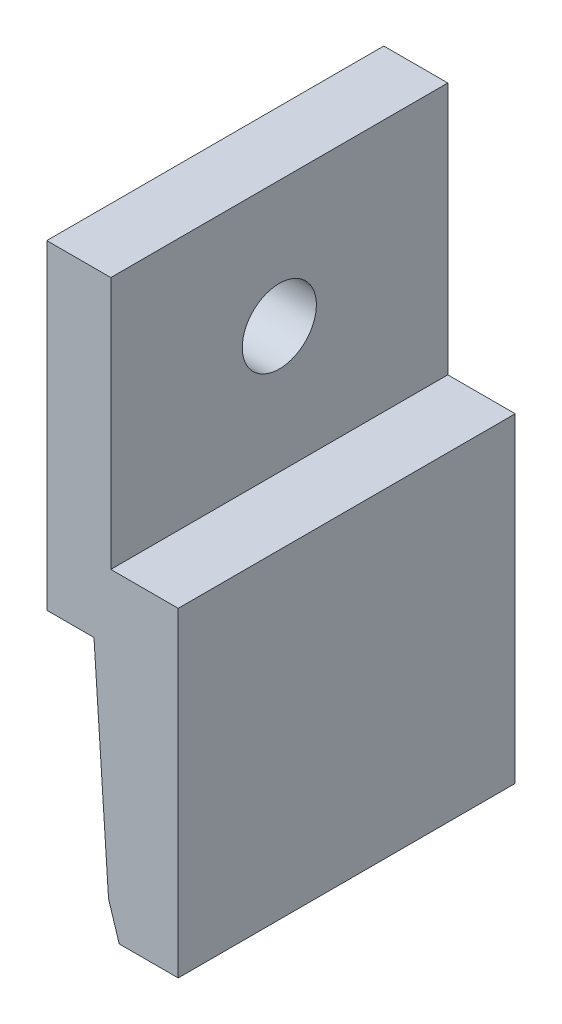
SolidWorks part; units mm, degrees
ref_plane "Спереди" through (0, 0, 0) normal (0, 0, 1) x (1, 0, 0)
ref_plane "Сверху" through (0, 0, 0) normal (0, 1, 0) x (1, 0, 0)
ref_plane "Справа" through (0, 0, 0) normal (1, 0, 0) x (0, 0, -1)
sketch "Эскиз1" plane through (0, 0, 0) normal (0, 0, 1) x (1, 0, 0)
  line L0 (0, 29.4375) -> (0, -32.8125) construction
  line L1 (0, -32.8125) -> (0, 0) construction
  line L2 (0, 0) -> (34.125, 0) construction
  line L3 (34.125, 0) -> (-36, 0) construction
  line L4 (-2, 15) -> (2, 15)
  line L5 (2, 15) -> (2, 0)
  line L6 (2, 0) -> (6, 0)
  line L7 (6, 0) -> (6, -19)
  line L8 (6, -19) -> (-2, -19)
  line L9 (-2, -19) -> (-2, 15)
  dimension "D1" = 2
  dimension "D2" = 2
  dimension "D3" = 4
  dimension "D4" = 15
  dimension "D5" = 19
extrude "Бобышка-Вытянуть1" add sketch "Эскиз1" along normal blind 20
sketch "Эскиз4" plane through (0, 0, 20) normal (0, 0, 1) x (1, 0, 0)
  line L0 (-2, -19) -> (6, -19) construction
  line L1 (6, -19) -> (6, 0) construction
  line L2 (2, -19) -> (-2, -19)
  line L3 (-2, -19) -> (-2, -4)
  line L4 (-2, 15) -> (-2, -19) construction
  line L5 (-2, -4) -> (1, -4)
  line L6 (1, -4) -> (2, -19)
  point P0 (2, -19)
  point P1 (1, -4)
  dimension "D1" = 4
  dimension "D2" = 15
  dimension "D3" = 5
extrude "Вырез-Вытянуть1" cut sketch "Эскиз4" against normal blind 22
sketch "Эскиз6" plane through (-2, 0, 0) normal (-1, 0, 0) x (0, 0, 1)
  line L0 (0, 15) -> (20, 15)
  line L1 (20, 15) -> (20, -4)
  line L2 (20, -4) -> (0, -4)
  line L3 (0, -4) -> (0, 15)
extrude "Вырез-Вытянуть2" cut sketch "Эскиз6" against normal blind 0.2
sketch "Эскиз8" plane through (0, 0, 20) normal (0, 0, 1) x (1, 0, 0)
  line L0 (2, -19) -> (1.8667, -17)
  line L1 (2, -19) -> (1, -4) construction
  line L2 (1.8667, -17) -> (2.5, -19)
  line L3 (2, -19) -> (6, -19) construction
  line L4 (2.5, -19) -> (2, -19)
  dimension "D1" = 0.5
  dimension "D2" = 2
extrude "Вырез-Вытянуть3" cut sketch "Эскиз8" against normal blind 21
sketch "Эскиз9" plane through (2, 0, 0) normal (1, 0, 0) x (0, 0, -1)
  line L0 (0, 15) -> (-20, 0) construction
  line L1 (-20, 0) -> (-20, 15) construction
  line L2 (-20, 15) -> (0, 0) construction
  circle A0 centre (-10, 7.5) radius 2.2
extrude "Вырез-Вытянуть4" cut sketch "Эскиз9" against normal blind 5
